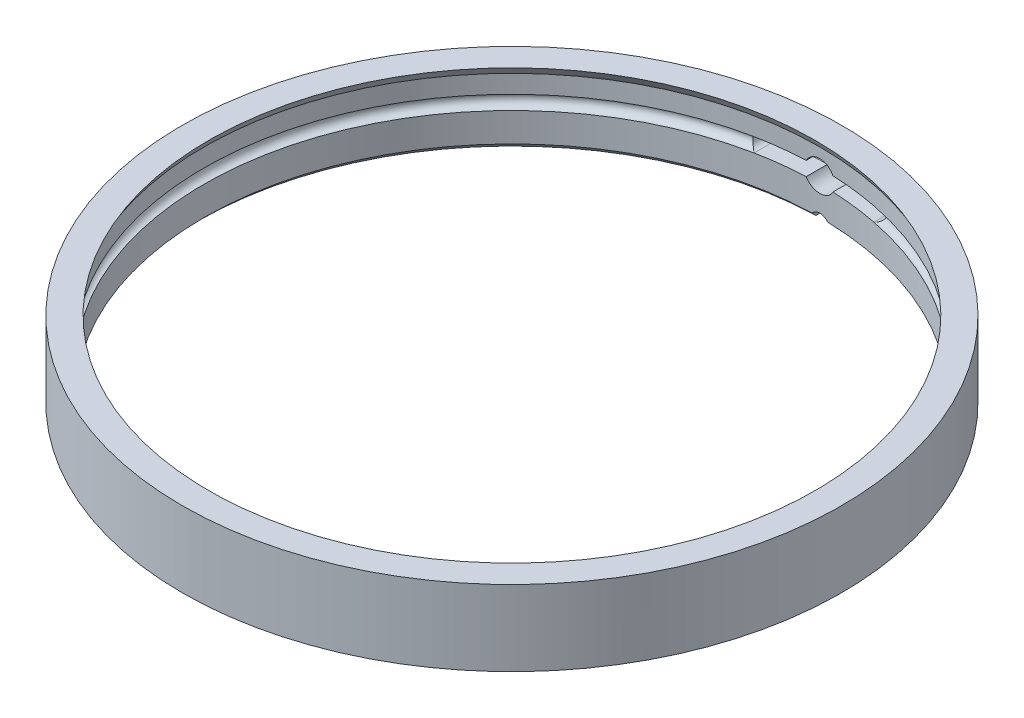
SolidWorks part; units mm, degrees
ref_plane "Front Plane" through (0, 0, 0) normal (0, 0, 1) x (1, 0, 0)
ref_plane "Top Plane" through (0, 0, 0) normal (0, 1, 0) x (1, 0, 0)
ref_plane "Right Plane" through (0, 0, 0) normal (1, 0, 0) x (0, 0, -1)
sketch "Sketch1" plane through (0, 0, 0) normal (0, 1, 0) x (1, 0, 0)
  circle A0 centre (0, 0) radius 83.185
  dimension "D1" = 166.37
extrude "Boss-Extrude1" add sketch "Sketch1" along normal blind 19.05
sketch "Sketch2" plane through (0, 19.05, 0) normal (0, 1, 0) x (1, 0, 0)
  line L0 (0, 0) -> (0, 83.185)
  circle A0 centre (0, 0) radius 83.185 construction
ref_plane "Plane1" through (0, 0, 0) normal (1, 0, 0) x (0, 0, -1)
sketch "Sketch3" plane through (0, 0, 0) normal (1, 0, 0) x (0, 0, -1)
  line L0 (77.7286, 0) -> (77.7286, 8.89)
  line L1 (77.7286, 10.668) -> (77.7286, 8.89)
  line L4 (77.7286, 12.446) -> (77.7286, 17.018)
  line L5 (77.7286, 17.018) -> (76.5554, 19.05)
  line L6 (0, 0) -> (0, 19.05)
  line L7 (83.185, 19.05) -> (-83.185, 19.05) construction
  line L9 (0, 0) -> (77.7286, 0)
  line L10 (0, 19.05) -> (83.185, 19.05) construction
  line L11 (76.5554, 19.05) -> (0, 19.05)
  circle A2 centre (77.7286, 10.668) radius 1.778
  dimension "D1" = 8.89
  dimension "D2" = 3.556
  dimension "D3" = 77.7286
  dimension "D4" = 2.032
  dimension "D5" = 150
revolve "Cut-Revolve1" cut sketch "Sketch3" angle 360 about L6
sketch "Sketch5" plane through (0, 0, 0) normal (0, -1, 0) x (1, 0, 0)
  line L0 (0, 0) -> (-31.8639, -76.8403)
  line L1 (0, 0) -> (-83.185, 0)
  line L2 (-25.6789, -61.925) -> (-27.5907, -50.5746)
  line L3 (-27.5907, -50.5746) -> (-21.9432, -52.9164)
  dimension "D1" = 67.477
  dimension "D2" = 83.185
ref_plane "Plane2" through (-31.8639, 0, -76.8403) normal (-0.383, 0, -0.9237) x (-0.9237, 0, 0.383)
ref_plane "Plane3" through (0, 0, -83.185) normal (0, 0, -1) x (-1, 0, 0)
sketch "Sketch7" plane through (0, 0, -83.185) normal (0, 0, -1) x (-1, 0, 0)
  line L0 (0, 19.05) -> (0, 0)
  line L4 (-0.498, 0) -> (0, 0)
  circle A0 centre (0, 0) radius 2.54
  dimension "D1" = 5.08
extrude "Cut-Extrude1" cut sketch "Sketch7" against normal blind 12.7
sketch "Sketch8" plane through (0, 0, -83.185) normal (0, 0, -1) x (-1, 0, 0)
  line L0 (0, 0) -> (0, 10.668)
  line L2 (15.113, 8.89) -> (-15.113, 8.89)
  line L3 (15.113, 8.89) -> (15.113, 12.446)
  line L4 (15.113, 12.446) -> (-15.113, 12.446)
  line L5 (-15.113, 8.89) -> (-15.113, 12.446)
  line L6 (15.113, 8.89) -> (-15.113, 12.446) construction
  line L7 (15.113, 12.446) -> (-15.113, 8.89) construction
  circle A0 centre (15.113, 10.668) radius 1.778
  circle A1 centre (-15.113, 10.668) radius 1.778
  circle A2 centre (0, 10.668) radius 3.81
  point P11 (-16.891, 10.668)
  point P12 (16.891, 10.668)
  point P14 (0, 6.858)
  dimension "D3" = 7.62
  dimension "D4" = 8.89
  dimension "D1" = 3.556
  dimension "D2" = 33.782
extrude "Cut-Extrude2" cut sketch "Sketch8" against normal up to surface (5.5295 mm away)
chamfer "Chamfer1" distance 1.5875 angle 45 1 edges at (0, 0, 77.7286)
